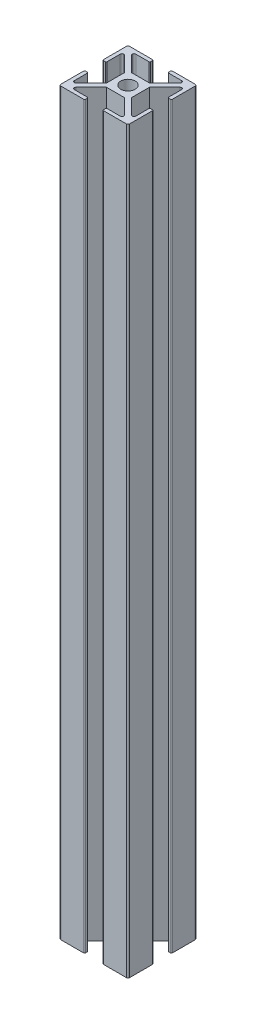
SolidWorks part; units mm, degrees
ref_plane "Front Plane" through (0, 0, 0) normal (0, 0, 1) x (1, 0, 0)
ref_plane "Top Plane" through (0, 0, 0) normal (0, 1, 0) x (1, 0, 0)
ref_plane "Right Plane" through (0, 0, 0) normal (1, 0, 0) x (0, 0, -1)
sketch "Sketch2" plane through (0, 0, 0) normal (0, 1, 0) x (1, 0, 0)
  line L12 (-10, -8.9393) -> (8.9393, 10)
  line L13 (-3.66, -3.66) -> (3.66, -3.66)
  line L26 (-3.66, -3.66) -> (-3.66, 3.66)
  line L27 (-3.66, 3.66) -> (3.66, 3.66)
  line L32 (3.66, -3.66) -> (3.66, 3.66)
  line L37 (-3.66, -3.66) -> (3.66, 3.66) construction
  line L50 (-3.66, 3.66) -> (3.66, -3.66) construction
  line L51 (-10, -8.9393) -> (-8.9393, -10)
  line L52 (8.9393, 10) -> (10, 8.9393)
  line L53 (-8.9393, -10) -> (10, 8.9393)
  line L54 (-10, -8.9393) -> (10, 8.9393) construction
  line L55 (8.9393, 10) -> (-8.9393, -10) construction
  line L56 (0, 0) -> (0, 25.4805) construction
  line L57 (10, 8.9393) -> (2.63, 8.9393)
  line L58 (-10, -8.9393) -> (-10, -10)
  line L59 (-10, -10) -> (-8.9393, -10)
  line L60 (10, 8.9393) -> (10, 10)
  line L61 (10, 10) -> (2.63, 10)
  line L62 (2.63, 8.9393) -> (2.63, 10)
  line L63 (5.995, 7.0557) -> (5.995, 8.9393)
  line L64 (10, 10) -> (10, 2.63)
  line L65 (8.9393, 10) -> (10, 10)
  line L66 (8.9393, 2.63) -> (10, 2.63)
  line L67 (8.9393, 10) -> (8.9393, 2.63)
  circle A0 centre (0, 0) radius 2.095
  point P0 (0, 0)
  dimension "D3" = 4.19
  dimension "D1" = 7.32
  dimension "D2" = 7.32
  dimension "D4" = 20
  dimension "D5" = 1.5
  dimension "D6" = 2.63
  dimension "D8" = 5.995
  dimension "D7" = 90
extrude "Boss-Extrude1" add sketch "Sketch2" along normal blind 215 contours L53 L67 L66 L64 | L67 L57 L12 L27 L32 L53 | L67 L12 L57 | L52 L67 L57 | L60 L61 L52 | L57 L67 L53 | L62 L57 L12 L61 | A0 L53 L32 L27 L12 | A0 L53 L13 L32 | A0 L12 L27 L26 | A0 L12 L26 L13 L53
fillet "Fillet1" radius 0.5 3 edges at (7.8787, 107.5, -8.9393) (8.9393, 107.5, -7.8787) (10, 107.5, -10)
fillet "Fillet2" radius 0.25 4 edges at (2.63, 107.5, -10) (2.63, 107.5, -8.9393) (8.9393, 107.5, -2.63) (10, 107.5, -2.63)
pattern_circular "CirPattern1" count 4 over 360 about axis through (0, 0, 0) along (0, 1, 0) of "Boss-Extrude1", "Fillet2", "Fillet1"
sketch "Sketch3" plane through (-10, 0, 0) normal (-1, 0, 0) x (0, 0, 1)
  line L0 (2.5993, 0) -> (-2.5993, 0) construction
  line L1 (10, 215) -> (10, 0) construction
  line L2 (10, 107.5) -> (-10, 107.5) construction
  line L3 (-10, 247.5) -> (-10, -32.5) construction
  circle A0 centre (0, 25) radius 2.095
  circle A1 centre (0, 190) radius 2.095
  dimension "D1" = 4.19
  dimension "D2" = 25
  dimension "D3" = 10
